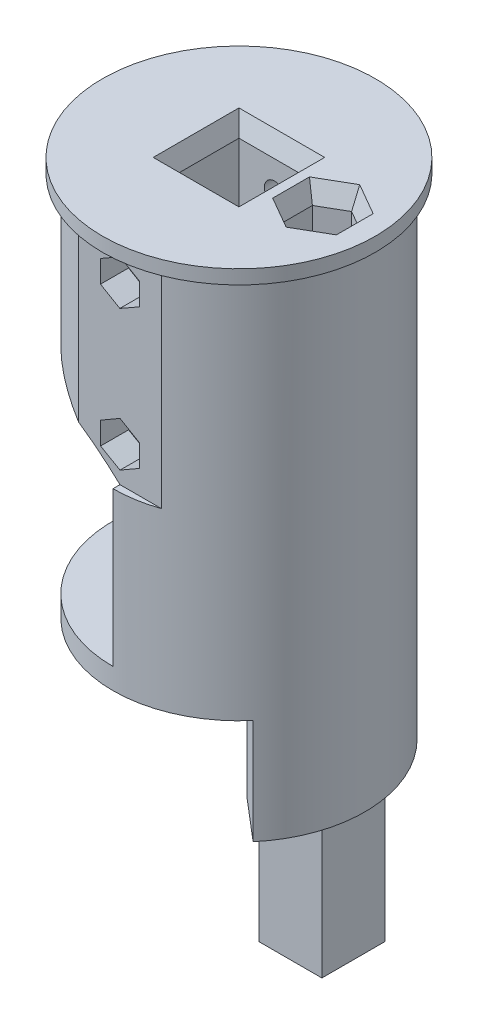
SolidWorks part; units mm, degrees
ref_plane "Спереди" through (0, 0, 0) normal (0, 0, 1) x (1, 0, 0)
ref_plane "Сверху" through (0, 0, 0) normal (0, 1, 0) x (1, 0, 0)
ref_plane "Справа" through (0, 0, 0) normal (1, 0, 0) x (0, 0, -1)
sketch "Эскиз1" plane through (0, 0, 0) normal (0, 1, 0) x (1, 0, 0)
  circle A0 centre (0, 0) radius 18
  dimension "D1" = 36
extrude "Бобышка-Вытянуть1" add sketch "Эскиз1" along normal blind 55
sketch "Эскиз2" plane through (0, 55, 0) normal (0, 1, 0) x (1, 0, 0)
  circle A0 centre (0, 0) radius 19.5
  dimension "D1" = 39
extrude "Бобышка-Вытянуть2" add sketch "Эскиз2" along normal blind 2
sketch "Эскиз3" plane through (0, 57, 0) normal (0, 1, 0) x (1, 0, 0)
  line L1 (-5.125, -5.125) -> (5.125, -5.125)
  line L2 (-5.125, -5.125) -> (-5.125, 5.125)
  line L3 (-5.125, 5.125) -> (5.125, 5.125)
  line L4 (5.125, -5.125) -> (5.125, 5.125)
  line L5 (-5.125, -5.125) -> (5.125, 5.125) construction
  line L6 (-5.125, 5.125) -> (5.125, -5.125) construction
  point P0 (0, 0)
  dimension "D1" = 10.25
extrude "Вырез-Вытянуть1" cut sketch "Эскиз3" against normal blind 40
sketch "Эскиз4" plane through (0, 0, 0) normal (0, -1, 0) x (1, 0, 0)
  line L0 (0, 0) -> (11.5702, 13.7888) construction
  line L1 (0, 0) -> (11.5702, -13.7888) construction
  line L2 (11.5702, 13.7888) -> (11.5702, -13.7888) construction
  line L3 (0, 0) -> (13.6996, 11.6756) construction
  line L5 (5.1423, -6.1284) -> (11.5702, -13.7888)
  line L6 (5.1423, -6.1284) -> (5.1423, 4.3826)
  line L7 (5.1423, 4.3826) -> (13.6996, 11.6756)
  circle A3 centre (0, 0) radius 18 construction
  arc A4 (13.6996, 11.6756) -> (11.5702, -13.7888) centre (0, 0) cw
  point P3 (28.5463, 60.4596)
  point P4 (0, 0)
  point P5 (11.5702, 13.7888)
  point P7 (0, 0)
  point P8 (11.5702, -13.7888)
  dimension "D1" = 100
  dimension "D2" = 3
  dimension "D3" = 10
extrude "Бобышка-Вытянуть3" add sketch "Эскиз4" along normal blind 15
sketch "Sketch1" plane through (0, -15, 0) normal (0, -1, 0) x (1, 0, 0)
  circle A0 centre (0, 0) radius 18
  arc A3 (13.6996, 11.6756) -> (11.5702, -13.7888) centre (0, 0) ccw construction
extrude "Boss-Extrude1" add sketch "Sketch1" along normal blind 20
sketch "Sketch3" plane through (0, -35, 0) normal (0, -1, 0) x (1, 0, 0)
  circle A0 centre (0, 0) radius 18
  circle A3 centre (0, 0) radius 18 construction
extrude "Boss-Extrude2" add sketch "Sketch3" along normal blind 7
sketch "Sketch4" plane through (0, -42, 0) normal (0, -1, 0) x (1, 0, 0)
  line L1 (5.1, 5.1) -> (-5.1, 5.1)
  line L2 (5.1, 5.1) -> (5.1, -5.1)
  line L3 (5.1, -5.1) -> (-5.1, -5.1)
  line L4 (-5.1, 5.1) -> (-5.1, -5.1)
  line L5 (5.1, 5.1) -> (-5.1, -5.1) construction
  line L6 (5.1, -5.1) -> (-5.1, 5.1) construction
  point P0 (0, 0)
  dimension "D1" = 10.2
  dimension "D2" = 10.2
extrude "Cut-Extrude2" cut sketch "Sketch4" against normal blind 27
sketch "Sketch6" plane through (0, 0, 0) normal (0, -1, 0) x (1, 0, 0)
  line L0 (0, 18) -> (0, -18) construction
  line L1 (0, 18) -> (0, -18)
  arc A0 (13.6996, 11.6756) -> (11.5702, -13.7888) centre (0, 0) ccw construction
  arc A1 (0, -18) -> (0, 18) centre (0, 0) cw
extrude "Cut-Extrude4" cut sketch "Sketch6" against normal blind 25
sketch "Sketch8" plane through (0, 0, 0) normal (0, -1, 0) x (1, 0, 0)
  line L0 (0, -18) -> (0, 18)
  arc A0 (0, -18) -> (0, 18) centre (0, 0) cw
  arc A1 (13.6996, 11.6756) -> (0, 18) centre (0, 0) ccw construction
extrude "Boss-Extrude3" add sketch "Sketch8" against normal blind 3
sketch "Sketch9" plane through (0, 0, 0) normal (-1, 0, 0) x (0, 0, 1)
  line L0 (-18, 3) -> (18, 25) construction
  line L2 (18, 25) -> (-18, 25)
  line L3 (18, 25) -> (18, 3)
  line L4 (18, 3) -> (-18, 3)
  line L5 (-18, 25) -> (-18, 3)
  line L6 (18, 25) -> (-18, 3) construction
  line L7 (18, 3) -> (-18, 25) construction
  point P4 (0, 14)
extrude "Cut-Extrude5" cut sketch "Sketch9" against normal blind 8
sketch "Sketch10" plane through (0, 0, 0) normal (0, -1, 0) x (1, 0, 0)
  line L0 (0, -18) -> (0, 18) construction
  line L2 (1.5, 8.7) -> (-1.5, 8.7)
  line L3 (1.5, 8.7) -> (1.5, 6.7)
  line L4 (1.5, 6.7) -> (-1.5, 6.7)
  line L5 (-1.5, 8.7) -> (-1.5, 6.7)
  line L6 (1.5, 8.7) -> (-1.5, 6.7) construction
  line L7 (1.5, 6.7) -> (-1.5, 8.7) construction
  circle A0 centre (0, 0) radius 3.7
  arc A1 (13.6996, 11.6756) -> (11.5702, -13.7888) centre (0, 0) ccw construction
  point P9 (0, 7.7)
  point P14 (0, 3.7)
  point P15 (0, 0)
  dimension "D1" = 7.4
  dimension "D2" = 2
  dimension "D3" = 3
  dimension "D4" = 4
extrude "Cut-Extrude6" cut sketch "Sketch10" against normal blind 10
sketch "Sketch11" plane through (0, -42, 0) normal (0, -1, 0) x (1, 0, 0)
  line L0 (-18, 0) -> (18, 0) construction
  circle A0 centre (0, 0) radius 18 construction
  circle A1 centre (12, 0) radius 2
  dimension "D1" = 4
  dimension "D2" = 6
extrude "Cut-Extrude7" cut sketch "Sketch11" against normal blind 102
sketch "Sketch15" plane through (0, -42, 0) normal (0, -1, 0) x (1, 0, 0)
  circle A0 centre (0, 0) radius 18
  circle A3 centre (0, 0) radius 18 construction
extrude "Cut-Extrude9" cut sketch "Sketch15" against normal blind 27
sketch "Sketch17" plane through (0, 25, 0) normal (0, -1, 0) x (1, 0, 0)
  line L2 (-18, 0) -> (14.8, 0) construction
  line L3 (14.8, 0) -> (13.8, 0) construction
  line L4 (0, 18) -> (0, -18) construction
  line L6 (5.9161, -17) -> (-5.9161, -17)
  line L7 (5.9161, 17) -> (-5.9161, 17)
  arc A0 (8, 16.1245) -> (8, -16.1245) centre (0, 0) ccw construction
  arc A1 (-5.9161, -17) -> (5.9161, -17) centre (0, 0) ccw
  arc A2 (-5.9161, 17) -> (5.9161, 17) centre (0, 0) cw
  point P14 (13.8, 0)
  point P20 (0, -17)
  point P23 (0, 17)
  dimension "D4" = 1
extrude "Cut-Extrude11" cut sketch "Sketch17" against normal blind 30
sketch "Sketch18" plane through (0, 0, -17) normal (0, 0, 1) x (1, 0, 0)
  line L0 (0, 25) -> (0, 55) construction
  line L1 (5.9161, 25) -> (-5.9161, 25) construction
  line L2 (5.9161, 55) -> (-5.9161, 55) construction
  circle A0 centre (0, 30) radius 1.5
  circle A1 centre (0, 50) radius 1.5
  point P3 (0, 40)
  dimension "D1" = 3
  dimension "D2" = 10
  dimension "D3" = 20
extrude "Cut-Extrude12" cut sketch "Sketch18" along normal through all
sketch "Sketch19" plane through (0, 0, -17) normal (0, 0, 1) x (1, 0, 0)
  circle A0 centre (0, 30) radius 3
  circle A1 centre (0, 50) radius 3
  dimension "D1" = 6
extrude "Cut-Extrude13" cut sketch "Sketch19" along normal blind 3
sketch "Sketch23" plane through (0, 3, 0) normal (0, 1, 0) x (1, 0, 0)
  line L0 (0, 18) -> (0, -18) construction
  line L1 (0, -14.4) -> (8, -14.4)
  line L2 (8, 16.1245) -> (8, -16.1245) construction
  line L3 (0, 14.4) -> (8, 14.4)
  line L4 (0, -14.4) -> (0, -18)
  line L5 (0, 14.4) -> (0, 18)
  line L6 (8, -14.4) -> (8, -16.1245)
  line L7 (8, 16.1245) -> (8, 14.4)
  arc A0 (8, 16.1245) -> (8, -16.1245) centre (0, 0) ccw construction
  arc A1 (0, -18) -> (8, -16.1245) centre (0, 0) ccw
  arc A2 (0, 18) -> (8, 16.1245) centre (0, 0) cw
  arc A3 (-5.9161, 17) -> (-5.9161, -17) centre (0, 0) ccw construction
  arc A4 (11.5702, 13.7888) -> (13.6996, -11.6756) centre (0, 0) ccw construction
  dimension "D1" = 3.6
extrude "Boss-Extrude5" add sketch "Sketch23" along normal blind 22
sketch "Sketch25" plane through (0, 0, 17) normal (0, 0, 1) x (1, 0, 0)
  line L0 (0, 55) -> (0, 25) construction
  line L1 (2.7713, 28.4) -> (2.7713, 31.6)
  line L2 (2.7713, 31.6) -> (0, 33.2)
  line L3 (0, 33.2) -> (-2.7713, 31.6)
  line L4 (-2.7713, 31.6) -> (-2.7713, 28.4)
  line L5 (-2.7713, 28.4) -> (0, 26.8)
  line L6 (0, 26.8) -> (2.7713, 28.4)
  line L7 (-5.9161, 55) -> (5.9161, 55) construction
  line L9 (-2.7821, 48.4189) -> (-0.0218, 46.8001)
  line L10 (-0.0218, 46.8001) -> (2.7603, 48.3811)
  line L11 (2.7603, 48.3811) -> (2.7821, 51.5811)
  line L12 (2.7821, 51.5811) -> (0.0218, 53.1999)
  line L13 (0.0218, 53.1999) -> (-2.7603, 51.6189)
  line L14 (-2.7603, 51.6189) -> (-2.7821, 48.4189)
  circle A0 centre (0, 30) radius 3.2 construction
  circle A1 centre (0, 50) radius 3.2 construction
  point P24 (0, 40)
  dimension "D1" = 6.4
  dimension "D2" = 20
  dimension "D3" = 10
extrude "Cut-Extrude16" cut sketch "Sketch25" against normal blind 4
sketch "Sketch26" plane through (0, 57, 0) normal (0, 1, 0) x (1, 0, 0)
  line L0 (14.8, 0) -> (5.125, 0) construction
  line L2 (8.4493, -2.05) -> (12, -4.1)
  line L3 (12, -4.1) -> (15.5507, -2.05)
  line L4 (15.5507, -2.05) -> (15.5507, 2.05)
  line L5 (15.5507, 2.05) -> (12, 4.1)
  line L6 (12, 4.1) -> (8.4493, 2.05)
  line L7 (5.125, -5.125) -> (5.125, 5.125) construction
  line L8 (8.4493, 2.05) -> (8.4493, -2.05)
  circle A0 centre (12, 0) radius 4.1 construction
  point P2 (15.5507, 0)
  dimension "D1" = 8.2
extrude "Cut-Extrude17" cut sketch "Sketch26" against normal blind 25.4
sketch "Sketch27" plane through (0, 0, 17) normal (0, 0, 1) x (1, 0, 0)
  line L0 (0, 25) -> (-20, 36.547) construction
  line L1 (-20, 36.547) -> (-20, 25)
  line L2 (-20, 25) -> (0, 25)
  line L3 (-18, 25) -> (-5.9161, 25) construction
  line L4 (-5.9161, 25) -> (0, 25) construction
  arc A0 (0, 25) -> (-20, 36.547) centre (-34.3242, -11.3572) ccw
  dimension "D3" = 50
  dimension "D1" = 30
  dimension "D2" = 20
extrude "Cut-Extrude18" cut sketch "Sketch27" against normal through all
fillet "Fillet2" radius 5 2 edges at (8, 14, 14.4) (8, 14, -14.4)
sketch "Sketch30" plane through (8, 0, 0) normal (-1, 0, 0) x (0, 0, 1)
  line L0 (-9.4, 8) -> (9.4, 8) construction
  line L1 (-9.4, 25) -> (-9.4, 3) construction
  line L2 (9.4, 3) -> (9.4, 25) construction
  line L4 (9.4, 13) -> (-9.4, 13)
  line L5 (9.4, 13) -> (9.4, 3)
  line L6 (9.4, 3) -> (-9.4, 3)
  line L7 (-9.4, 13) -> (-9.4, 3)
  line L8 (9.4, 13) -> (-9.4, 3) construction
  line L9 (9.4, 3) -> (-9.4, 13) construction
  point P6 (0, 8)
  dimension "D1" = 10
extrude "Cut-Extrude20" cut sketch "Sketch30" against normal blind 3
chamfer "Chamfer1" distance 1 angle 70 4 edges at (5.125, 57, 0) (0, 57, 5.125) (-5.125, 57, 0) (0, 57, -5.125)
chamfer "Chamfer2" distance 1 angle 70 6 edges at (15.5507, 57, 0) (13.7754, 57, 3.075) (13.7754, 57, -3.075) (10.2246, 57, -3.075) (8.4493, 57, 0) (10.2246, 57, 3.075)
sketch "Sketch37" plane through (0, -15, 0) normal (0, -1, 0) x (1, 0, 0)
  line L0 (5.1423, -0.8729) -> (17.9788, -0.8729) construction
  line L1 (5.1423, 4.3826) -> (5.1423, -6.1284) construction
  line L3 (15.4788, 3.6271) -> (6.4788, 3.6271)
  line L4 (15.4788, 3.6271) -> (15.4788, -5.3729)
  line L5 (15.4788, -5.3729) -> (6.4788, -5.3729)
  line L6 (6.4788, 3.6271) -> (6.4788, -5.3729)
  line L7 (15.4788, 3.6271) -> (6.4788, -5.3729) construction
  line L8 (15.4788, -5.3729) -> (6.4788, 3.6271) construction
  arc A0 (11.5702, -13.7888) -> (13.6996, 11.6756) centre (0, 0) ccw construction
  circle A1 centre (12, 0) radius 2
  point P8 (10.9788, -0.8729)
  dimension "D1" = 9
  dimension "D2" = 7
extrude "Boss-Extrude7" add sketch "Sketch37" along normal blind 20
sketch "Sketch38" plane through (0, -15, 0) normal (0, -1, 0) x (1, 0, 0)
  line L0 (5.1423, -6.1284) -> (5.1423, 4.3826)
  arc A0 (5.1423, -6.1284) -> (5.1423, 4.3826) centre (-10.9482, -0.8729) ccw
extrude "Cut-Extrude22" cut sketch "Sketch38" against normal up to surface (15 mm away)
sketch "Sketch39" plane through (0, -15, 0) normal (0, -1, 0) x (1, 0, 0)
  line L0 (7.4207, -7.3729) -> (15.4207, -7.3729)
  line L1 (7.4207, -7.3729) -> (11.5989, -12.3522)
  line L2 (5.1423, -6.1284) -> (11.5702, -13.7888) construction
  line L3 (6.4788, -5.3729) -> (15.4788, -5.3729) construction
  line L4 (6.1866, -7.3729) -> (16.4207, -7.3729) construction
  arc A0 (11.5989, -12.3522) -> (15.4207, -7.3729) centre (-0.5503, 0.9293) ccw
  arc A1 (11.5702, -13.7888) -> (13.6996, 11.6756) centre (0, 0) ccw construction
  point P11 (11.4207, -7.3729)
  dimension "D1" = 8
  dimension "D2" = 2
  dimension "D3" = 6.5
  dimension "D4" = 5
  dimension "D6" = 50
extrude "Cut-Extrude23" cut sketch "Sketch39" against normal up to surface (28 mm away)
sketch "Sketch40" plane through (0, 3, 0) normal (0, 1, 0) x (1, 0, 0)
  line L0 (7.4207, 7.3729) -> (7.4207, 11.736)
  line L1 (7.4207, 11.736) -> (11.7839, 11.736)
  line L2 (11.7839, 11.736) -> (11.7839, 7.3729)
  line L3 (11.7839, 7.3729) -> (7.4207, 7.3729)
  line L4 (7.4207, 7.3729) -> (11, 7.3729) construction
  arc A1 (8, 9.4) -> (3, 14.4) centre (3, 9.4) ccw construction
extrude "Cut-Extrude24" cut sketch "Sketch40" along normal up to surface (10 mm away)
fillet "Fillet7" radius 6 2 edges at (5.1423, -7.5, 4.3826) (5.1423, -7.5, -6.1284)
